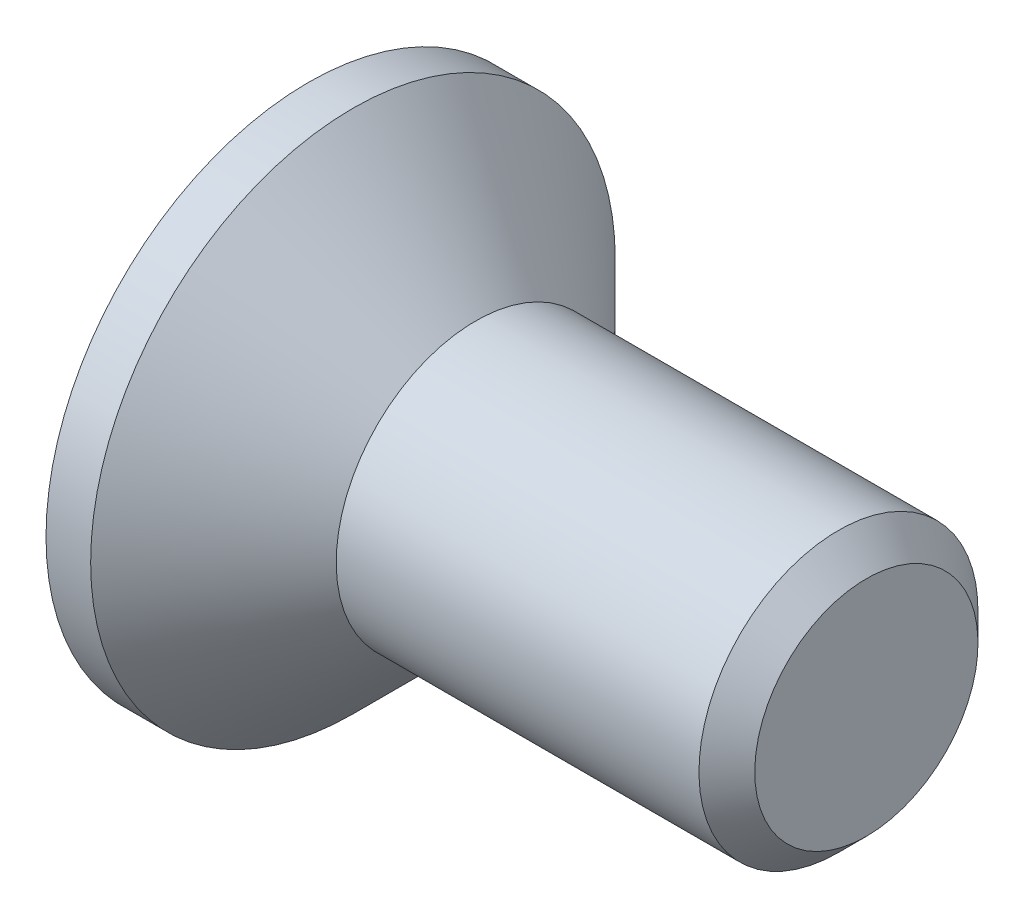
SolidWorks part; units mm, degrees
ref_plane "Front Plane" through (0, 0, 0) normal (0, 0, 1) x (1, 0, 0)
ref_plane "Top Plane" through (0, 0, 0) normal (0, 1, 0) x (1, 0, 0)
ref_plane "Right Plane" through (0, 0, 0) normal (1, 0, 0) x (0, 0, -1)
sketch "Sketch1" plane through (0, 0, 0) normal (0, 0, 1) x (1, 0, 0)
  line L1 (-1.5, 2.35) -> (-1.5, 0)
  line L2 (-1.5, 0) -> (3.5, 0)
  line L3 (3.5, 0) -> (3.5, 1.25)
  line L4 (3.5, 1.25) -> (0, 1.25)
  line L5 (-1.5, 2.35) -> (-1.1, 2.35)
  line L6 (-1.1, 2.35) -> (0, 1.25)
  dimension "D1" = 1.25
  dimension "D2" = 45
  dimension "D3" = 1.5
  dimension "D4" = 5
  dimension "D5" = 2.35
revolve "Revolve1" add sketch "Sketch1" angle 360 about L2
chamfer "Chamfer1" distance 0.25 angle 45 1 edges at (3.5, -1.25, 0)
sketch "Sketch2" plane through (-1.5, 0, 0) normal (-1, 0, 0) x (0, 0, 1)
  line L0 (-0.34, 1.35) -> (0.34, 1.35)
  line L1 (0.34, 1.35) -> (0.34, 0.34)
  line L2 (0.34, 0.34) -> (1.35, 0.34)
  line L3 (1.35, 0.34) -> (1.35, -0.34)
  line L4 (1.35, -0.34) -> (0.34, -0.34)
  line L5 (0.34, -0.34) -> (0.34, -1.35)
  line L6 (0.34, -1.35) -> (-0.34, -1.35)
  line L7 (-0.34, -1.35) -> (-0.34, -0.34)
  line L8 (-0.34, -0.34) -> (-1.35, -0.34)
  line L9 (-1.35, -0.34) -> (-1.35, 0.34)
  line L10 (-1.35, 0.34) -> (-0.34, 0.34)
  line L11 (-0.34, 0.34) -> (-0.34, 1.35)
  point P2 (0, 1.35)
  point P14 (0, -1.35)
  point P15 (1.35, 0)
  point P16 (-1.35, 0)
  dimension "D1" = 2.7
  dimension "D2" = 0.68
extrude "Cut-Extrude1" cut sketch "Sketch2" against normal blind 1.25
